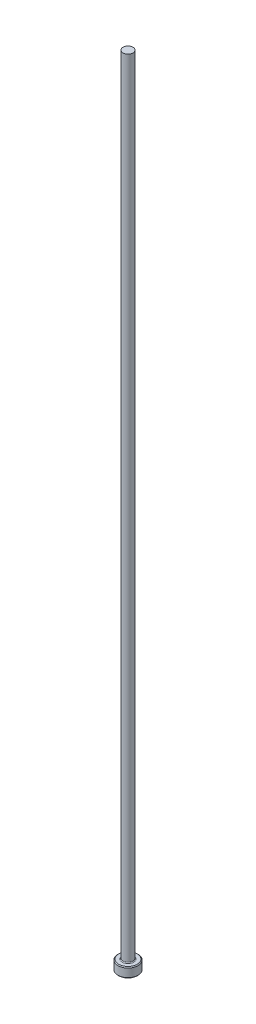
SolidWorks part; units mm, degrees
ref_plane "Front Plane" through (0, 0, 0) normal (0, 0, 1) x (1, 0, 0)
ref_plane "Top Plane" through (0, 0, 0) normal (0, 1, 0) x (1, 0, 0)
ref_plane "Right Plane" through (0, 0, 0) normal (1, 0, 0) x (0, 0, -1)
sketch "Sketch1" plane through (0, 0, 0) normal (0, 0, 1) x (1, 0, 0)
  line L0 (0, 259.9588) -> (0, -15.1925) construction
  line L1 (0, 0) -> (-3.175, 0)
  line L2 (-3.175, 0) -> (-3.175, 3.175)
  line L3 (-3.175, 3.175) -> (-1.5875, 3.175)
  line L4 (-1.5875, 3.175) -> (-1.5875, 254)
  line L5 (-1.5875, 254) -> (0, 254)
  line L6 (0, 254) -> (0, 0)
  dimension "L" = 254
  dimension "H" = 6.35
  dimension "T" = 3.175
  dimension "D" = 3.175
revolve "Revolve1" add sketch "Sketch1" angle 360 about L0
chamfer "Chamfer1" distance 0.254 angle 45 2 edges at (0, 3.175, 3.175) (0, 0, 3.175)
fillet "Fillet1" radius 0.254 1 edges at (0, 3.175, 1.5875)
sketch "Pocket Sketch" plane through (0, 0, 0) normal (0, 0, 1) x (1, 0, 0)
  line L0 (-3.5719, 0) -> (-3.5719, 3.2004)
  line L1 (-3.5719, 3.2004) -> (-2.5479, 3.2004)
  line L2 (-1.7859, 3.9624) -> (-1.7859, 22.225)
  line L3 (-1.7859, 22.225) -> (0, 22.225)
  line L4 (0, 22.225) -> (0, 0)
  line L5 (0, 0) -> (-3.5719, 0)
  line L6 (0, 12.6104) -> (0, -2.4989) construction
  line L7 (-3.175, 2.921) -> (-3.175, 0.254) construction
  line L8 (2.921, 3.175) -> (-2.921, 3.175) construction
  line L9 (-1.5875, 254) -> (-1.5875, 3.429) construction
  line L10 (-2.5479, 3.2004) -> (-1.7859, 3.9624)
  point P3 (-1.7859, 3.2004)
  dimension "D1" = 7.1437
  dimension "D2" = 0.3969
  dimension "D3" = 0.0254
  dimension "D4" = 0.1984
  dimension "D5" = 3.5719
  dimension "D6" = 22.225
